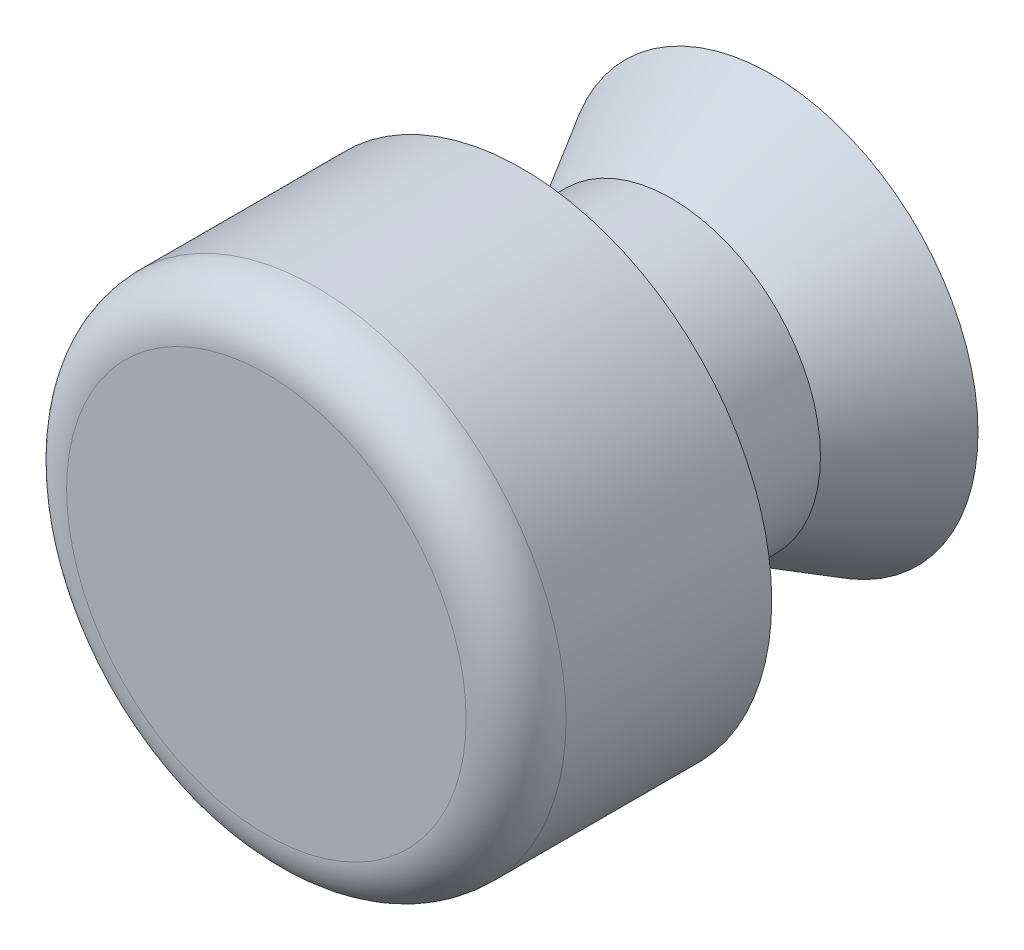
SolidWorks part; units mm, degrees
ref_plane "Спереди" through (0, 0, 0) normal (0, 0, 1) x (1, 0, 0)
ref_plane "Сверху" through (0, 0, 0) normal (0, 1, 0) x (1, 0, 0)
ref_plane "Справа" through (0, 0, 0) normal (1, 0, 0) x (0, 0, -1)
sketch "Эскиз1" plane through (0, 0, 0) normal (1, 0, 0) x (0, 0, -1)
  line L0 (0, 0) -> (25.1975, 0) construction
  line L1 (0, 0) -> (8.0264, 0)
  line L2 (8.0264, 0) -> (8.0264, 3.2851)
  line L3 (8.0264, 3.2851) -> (6.4389, 2.3685)
  line L4 (6.4389, 2.3685) -> (4.064, 2.3685)
  line L5 (4.064, 2.3685) -> (4.064, 3.9687)
  line L6 (4.064, 3.9687) -> (0.7938, 3.9687)
  line L7 (0, 3.175) -> (0, 0)
  arc A0 (0.7938, 3.9687) -> (0, 3.175) centre (0.7938, 3.175) ccw
  dimension "D7" = 0.7937
  dimension "D1" = 30
  dimension "D2" = 1.5875
  dimension "D3" = 3.9624
  dimension "D4" = 4.7371
  dimension "D5" = 7.9375
  dimension "D6" = 4.064
revolve "Повернуть1" add sketch "Эскиз1" angle 360 about L0
